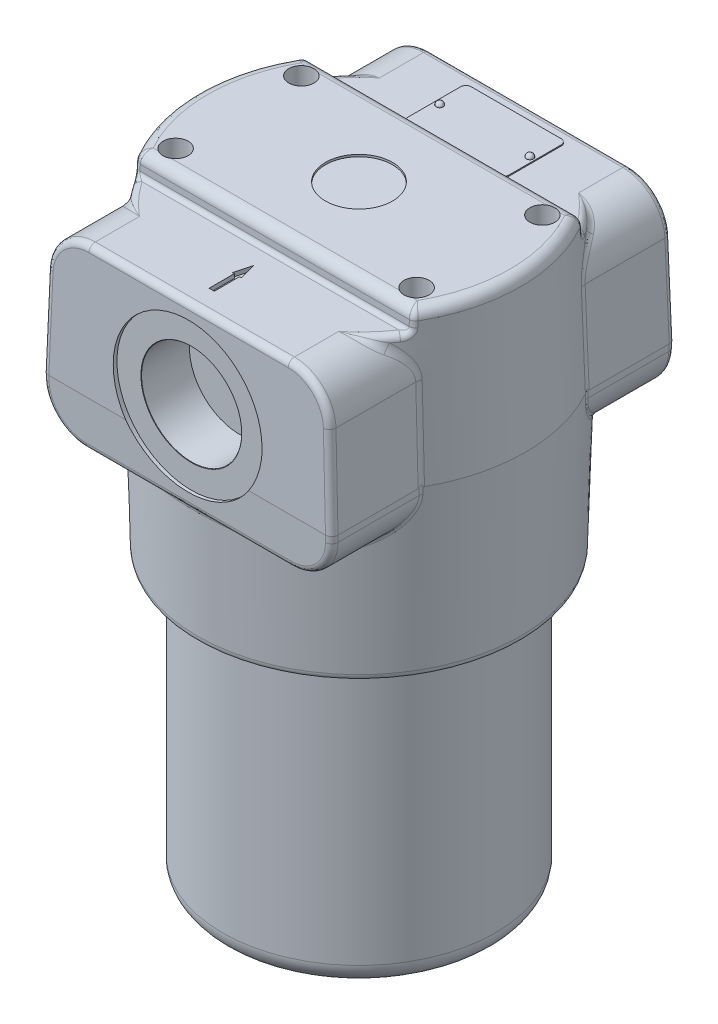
SolidWorks part; units mm, degrees
ref_plane "Front" through (0, 0, 0) normal (0, 0, 1) x (1, 0, 0)
ref_plane "Top" through (0, 0, 0) normal (0, 1, 0) x (1, 0, 0)
ref_plane "Right" through (0, 0, 0) normal (1, 0, 0) x (0, 0, -1)
imported_body "Imported1"
scale "Echelle1"
